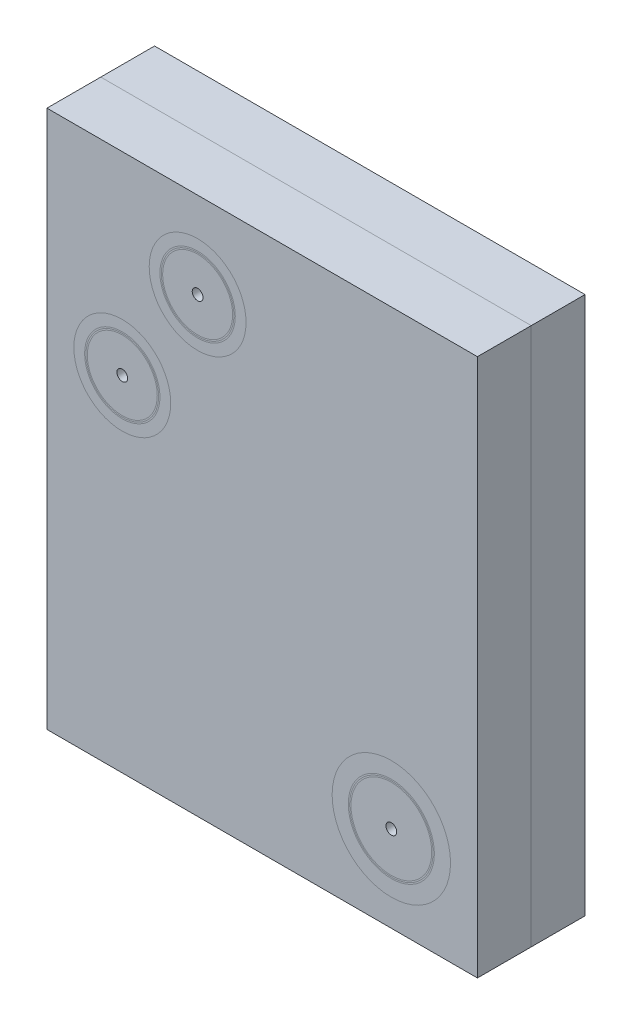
SolidWorks part; units mm, degrees
ref_plane "Front Plane" through (0, 0, 0) normal (0, 0, 1) x (1, 0, 0)
ref_plane "Top Plane" through (0, 0, 0) normal (0, 1, 0) x (1, 0, 0)
ref_plane "Right Plane" through (0, 0, 0) normal (1, 0, 0) x (0, 0, -1)
sketch "Sketch1" plane through (0, 0, 0) normal (0, 0, 1) x (1, 0, 0)
  line L1 (0, 0) -> (40, 0)
  line L2 (0, 0) -> (0, 50)
  line L3 (0, 50) -> (40, 50)
  line L4 (40, 0) -> (40, 50)
  dimension "D1" = 50
  dimension "D2" = 40
extrude "Boss-Extrude1" add sketch "Sketch1" along normal mid plane 10
sketch "Sketch2" plane through (0, 0, 5) normal (0, 0, 1) x (1, 0, 0)
  line L0 (0, 50) -> (0, 0) construction
  line L1 (40, 50) -> (0, 50) construction
  line L2 (0, 0) -> (40, 0) construction
  line L3 (40, 0) -> (40, 50) construction
  circle A0 centre (14, 42) radius 0.5
  circle A1 centre (7, 32) radius 0.5
  circle A2 centre (32, 8) radius 0.5
  dimension "D5" = 1
  dimension "D6" = 1
  dimension "D7" = 1
  dimension "D1" = 14
  dimension "D2" = 7
  dimension "D3" = 8
  dimension "D4" = 18
  dimension "D8" = 8
  dimension "D9" = 8
extrude "Cut-Extrude1" cut sketch "Sketch2" against normal through all
ref_plane "Plane1" through (0, 0, 0) normal (0, 0, 1) x (1, 0, 0)
split "Split1" trim tools "Plane1" bodies to split 102 resulting bodies 103 104
sketch "Sketch3" plane through (0, 0, 5) normal (0, 0, 1) x (1, 0, 0)
  circle A0 centre (32, 8) radius 3.875
  circle A1 centre (32, 8) radius 5.5
  circle A2 centre (32, 8) radius 4
  circle A3 centre (32, 8) radius 3.75
  dimension "D1" = 11
  dimension "D2" = 8
  dimension "D3" = 7.75
  dimension "D4" = 7.5
split "Split2" trim tools "Sketch3" bodies to split 103 104 resulting bodies 105 106 107 108 109 110 111 112 113 114
sketch "Sketch4" plane through (0, 0, 5) normal (0, 0, 1) x (1, 0, 0)
  circle A0 centre (14, 42) radius 3.25
  circle A1 centre (14, 42) radius 3.5
  circle A2 centre (14, 42) radius 3.375
  circle A3 centre (14, 42) radius 4.5
  circle A4 centre (7, 32) radius 3.25
  circle A5 centre (7, 32) radius 3.375
  circle A6 centre (7, 32) radius 3.5
  circle A7 centre (7, 32) radius 4.5
  dimension "D1" = 9
  dimension "D2" = 9
  dimension "D3" = 7
  dimension "D4" = 7
  dimension "D5" = 6.75
  dimension "D6" = 6.75
  dimension "D7" = 6.5
  dimension "D8" = 6.5
split "Split3" trim tools "Sketch4" bodies to split 114 109 112 107 113 108 105 110 111 106 resulting bodies 115 116 117 118 119 120 121 122 123 124 125 126 127 128 129 130 131 132 133 134 135 136 137 138 139 140
